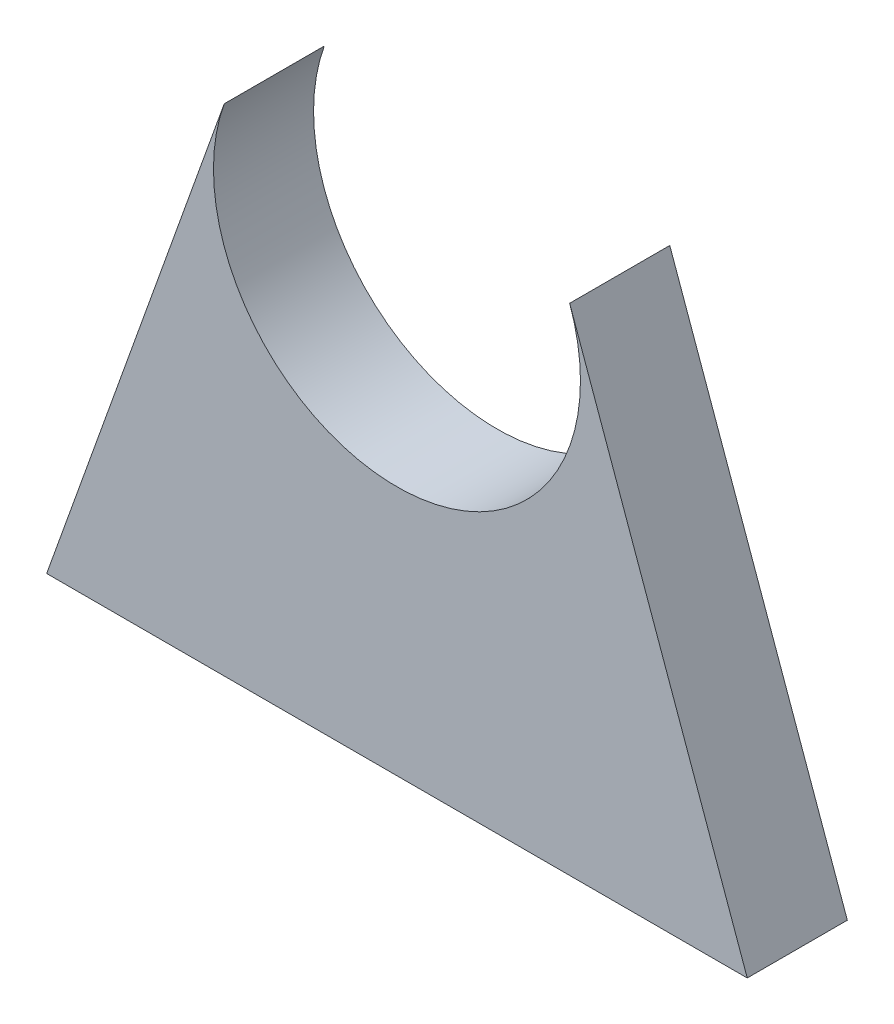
SolidWorks part; units mm, degrees
ref_plane "前视基准面" through (0, 0, 0) normal (0, 0, 1) x (1, 0, 0)
ref_plane "上视基准面" through (0, 0, 0) normal (0, 1, 0) x (1, 0, 0)
ref_plane "右视基准面" through (0, 0, 0) normal (1, 0, 0) x (0, 0, -1)
ref_plane "基准面1" through (0, 0, -6) normal (0, 0, 1) x (1, 0, 0)
ref_plane "基准面2" through (0, 0, 18) normal (0, 0, 1) x (1, 0, 0)
sketch "草图4" plane through (0, 0, 0) normal (0, 0, 1) x (1, 0, 0)
  line L0 (0, 53.8311) -> (0, -10.6851) construction
  line L1 (-10.3554, 35.7101) -> (-21, 6)
  line L2 (-24, 6) -> (24, 6) construction
  line L3 (-21, 6) -> (21, 6)
  line L4 (10.3554, 35.7101) -> (21, 6)
  arc A0 (-10.3554, 35.7101) -> (10.3554, 35.7101) centre (0, 32) ccw
  point P12 (0, 6)
  dimension "D1" = 22
  dimension "D2" = 21
extrude "凸台-拉伸1" add sketch "草图4" along normal blind 6
